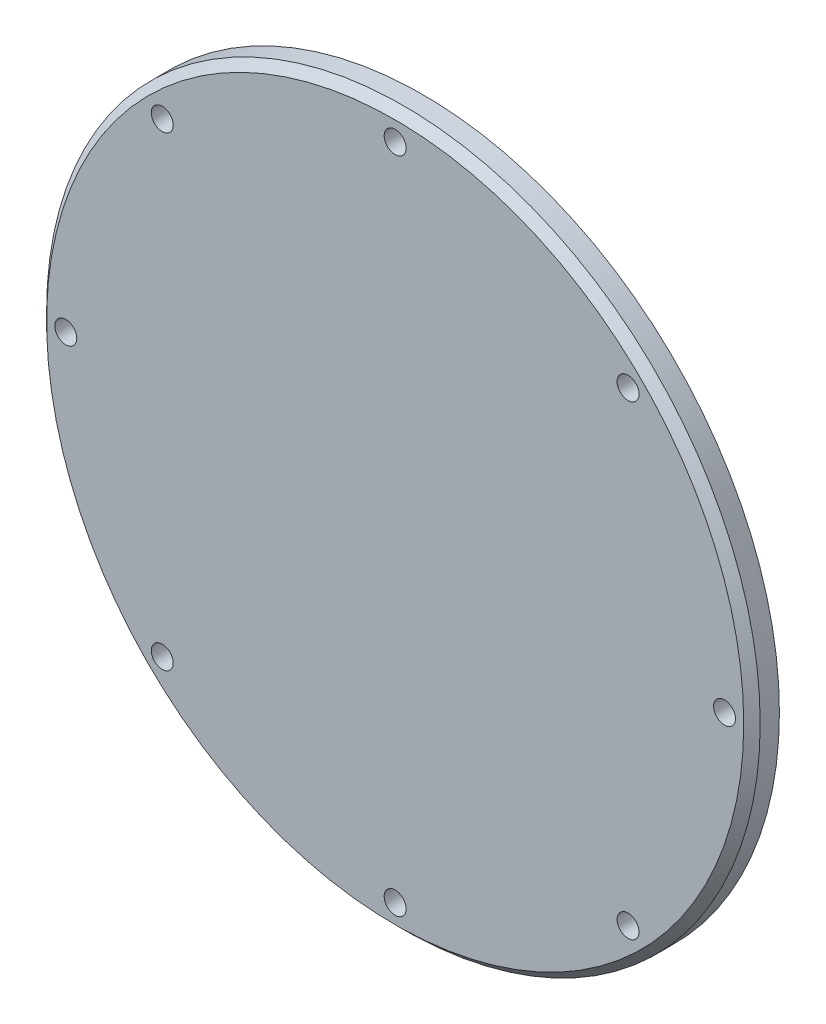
SolidWorks part; units mm, degrees
ref_plane "Plan de face" through (0, 0, 0) normal (0, 0, 1) x (1, 0, 0)
ref_plane "Plan de dessus" through (0, 0, 0) normal (0, 1, 0) x (1, 0, 0)
ref_plane "Plan de droite" through (0, 0, 0) normal (1, 0, 0) x (0, 0, -1)
sketch "Esquisse1" plane through (0, 0, 0) normal (0, 0, 1) x (1, 0, 0)
  circle A0 centre (-162.8978, -125) radius 130
  circle A1 centre (-78.045, -40.1472) radius 4 construction
  circle A2 centre (-162.8978, -5) radius 4 construction
  circle A3 centre (-247.7506, -40.1472) radius 4 construction
  circle A4 centre (-282.8978, -125) radius 4 construction
  circle A5 centre (-247.7506, -209.8528) radius 4 construction
  circle A6 centre (-162.8978, -245) radius 4 construction
  circle A7 centre (-78.045, -209.8528) radius 4 construction
  circle A8 centre (-42.8978, -125) radius 4 construction
  circle A9 centre (-78.045, -40.1472) radius 4
  circle A10 centre (-162.8978, -5) radius 4
  circle A11 centre (-247.7506, -40.1472) radius 4
  circle A12 centre (-282.8978, -125) radius 4
  circle A13 centre (-247.7506, -209.8528) radius 4
  circle A14 centre (-162.8978, -245) radius 4
  circle A15 centre (-78.045, -209.8528) radius 4
  circle A16 centre (-42.8978, -125) radius 4
  dimension "D1" = 260
extrude "Boss.-Extru.1" add sketch "Esquisse1" along normal blind 10
chamfer "Chanfrein1" distance 3 angle 45 1 edges at (-32.8978, -125, 10)
